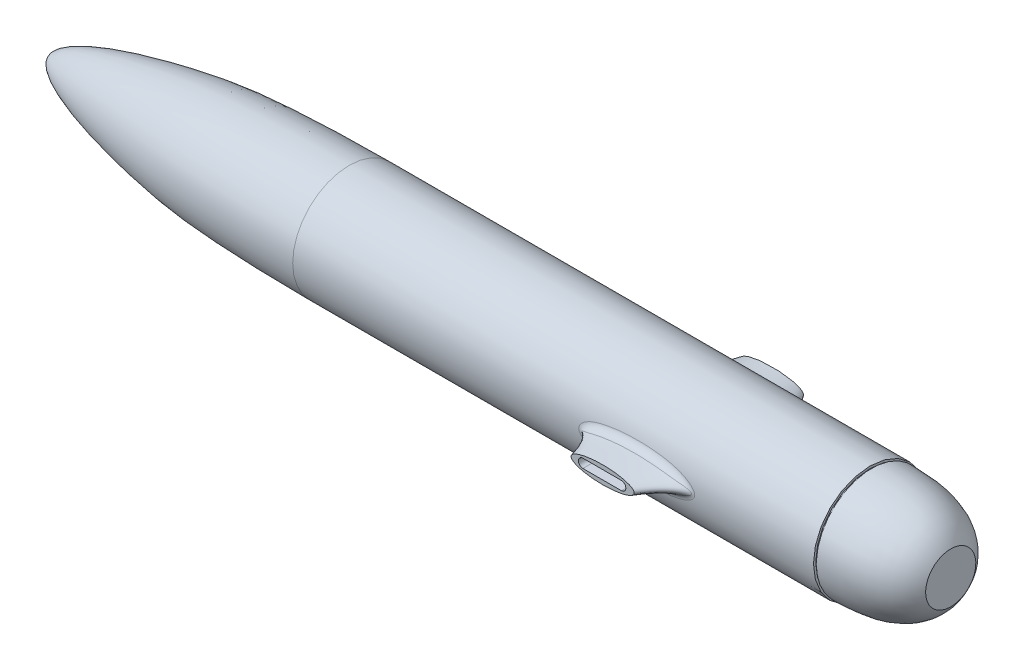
SolidWorks part; units mm, degrees
ref_plane "Plan de face" through (0, 0, 0) normal (0, 0, 1) x (1, 0, 0)
ref_plane "Plan de dessus" through (0, 0, 0) normal (0, 1, 0) x (1, 0, 0)
ref_plane "Plan de droite" through (0, 0, 0) normal (1, 0, 0) x (0, 0, -1)
imported_body "ellipsoide_nose-1-solid1"
imported_body "middle_cylinder-1-solid1"
imported_body "rear_case-1-solid1"
sketch "Esquisse1" plane through (0, 0, 0) normal (0, 0, 1) x (1, 0, 0)
  line L0 (-100, -100) -> (0, -100)
  line L1 (0, 100) -> (-100, 100)
  line L2 (0, 100) -> (-100, 100)
  line L3 (-630, 0) -> (965, 0)
  line L4 (0, 100) -> (630, 100)
  line L5 (630, -100) -> (0, -100)
  line L7 (0, 100) -> (630, 100)
  line L8 (630, 100) -> (822, 100)
  line L9 (822, -100) -> (630, -100)
  line L11 (630, 100) -> (822, 100)
  line L12 (965, 44.4943) -> (965, -44.4943)
  line L13 (965, 44.4943) -> (965, 0)
  line L14 (822, 100) -> (822, 96)
  line L15 (822, -96) -> (822, -100)
  line L17 (822, 100) -> (822, 96)
  line L18 (822, 96) -> (825, 96)
  line L19 (825, -96) -> (822, -96)
  line L21 (822, 96) -> (825, 96)
  line L22 (825, -97.9954) -> (825, -96)
  line L23 (825, 96) -> (825, 97.9954)
  line L24 (825, 96) -> (825, 97.9954)
  line L26 (-667.2279, 0) -> (1008.8005, 0) construction
  spline S0 degree 3 poles (5361.9277, 96.4472) (-1543.6724, 242.0105) (-736.5004, -31.8953) (-83.3634, -130.9733) (1227.5599, -39.2142) (-6098.6718, -194.3881) knots -1.50944 -1.50944 -1.50944 -1.50944 0.558238 0.658238 2.284862 2.284862 2.284862 2.284862 only from (-630, 0) to (-100, -100)
  spline S1 degree 3 poles (-2099.8033, 118.2426) (673.3696, 74.4518) (-152.3841, 120.5032) (-643.0079, 46.0777) (-1166.4327, -118.3936) (1362.6463, -137.8992) knots -0.883897 -0.883897 -0.883897 -0.883897 0.341762 0.441762 1.966308 1.966308 1.966308 1.966308 only from (-100, 100) to (-630, 0)
  spline S2 degree 3 poles (-100, 100) (-162.1333, 100) (-304.5349, 97.4226) (-476.6711, 71.3103) (-630, 34.0848) (-630, 0) knots 0 0 0 0 0.341762 0.441762 1 1 1 1
  spline S4 degree 3 poles (2823.9368, 161.83) (759.5648, 92.9816) (773.8602, 98.353) (829.9944, 97.9674) (834.2417, 97.9099) (840.0872, 97.7834) (847.7058, 97.5116) (857.2422, 96.9383) (867.0715, 96.0519) (880.4349, 94.3621) (897.377, 91.1248) (917.3093, 84.85) (932.9199, 77.0765) (944.3364, 68.9747) (950.905, 63.0587) (955.7423, 57.7829) (958.5744, 54.2557) (960.7162, 51.2924) (961.9991, 49.3851) (962.8715, 48.0125) (963.3556, 47.2297) (963.7308, 46.6091) (964.0364, 46.0991) (978.5026, 22.0187) (982.0354, 15.2756) (2030.5577, -1647.6852) knots -1.246218 -1.246218 -1.246218 -1.246218 0.007429 0.039447 0.071466 0.103484 0.167521 0.231558 0.295595 0.359631 0.487705 0.615779 0.743853 0.807889 0.871926 0.903945 0.935963 0.951972 0.967982 0.975986 0.979988 0.983991 0.987993 0.991995 1.520304 1.520304 1.520304 1.520304 only from (825, 97.9954) to (965, 44.4943)
  spline S5 degree 3 poles (5763.8178, 7566.8524) (982.0284, -13.7912) (987.8882, -6.3956) (964.0364, -46.0991) (963.7308, -46.6091) (963.3556, -47.2297) (962.8715, -48.0125) (961.9991, -49.3851) (960.7162, -51.2924) (958.5744, -54.2557) (955.7423, -57.7829) (950.905, -63.0587) (944.3364, -68.9747) (932.9199, -77.0765) (917.3093, -84.85) (897.377, -91.1248) (880.4349, -94.3621) (867.0715, -96.0519) (857.2422, -96.9383) (847.7058, -97.5116) (840.0872, -97.7834) (834.2417, -97.9099) (829.9944, -97.9674) (739.8631, -98.5866) (757.4126, -84.0987) (9819.0802, -403.8978) knots -0.868259 -0.868259 -0.868259 -0.868259 0.008005 0.012007 0.016009 0.020012 0.024014 0.032018 0.048028 0.064037 0.096055 0.128074 0.192111 0.256147 0.384221 0.512295 0.640369 0.704405 0.768442 0.832479 0.896516 0.928534 0.960553 0.992571 3.044259 3.044259 3.044259 3.044259 only from (965, -44.4943) to (825, -97.9954)
  spline S7 degree 3 poles (825, 97.9954) (825.3075, 97.9945) (826.9499, 97.9883) (829.9944, 97.9674) (834.2417, 97.9099) (840.0872, 97.7834) (847.7058, 97.5116) (857.2422, 96.9383) (867.0715, 96.0519) (880.4349, 94.3621) (897.377, 91.1248) (917.3093, 84.85) (932.9199, 77.0765) (944.3364, 68.9747) (950.905, 63.0587) (955.7423, 57.7829) (958.5744, 54.2557) (960.7162, 51.2924) (961.9991, 49.3851) (962.8715, 48.0125) (963.3556, 47.2297) (963.7308, 46.6091) (964.0364, 46.0991) (964.4682, 45.3803) (964.7865, 44.8499) (965, 44.4943) knots 0 0 0 0 0.007429 0.039447 0.071466 0.103484 0.167521 0.231558 0.295595 0.359631 0.487705 0.615779 0.743853 0.807889 0.871926 0.903945 0.935963 0.951972 0.967982 0.975986 0.979988 0.983991 0.987993 0.991995 1 1 1 1
revolve "Révolution1" add sketch "Esquisse1" angle 360 about L26
